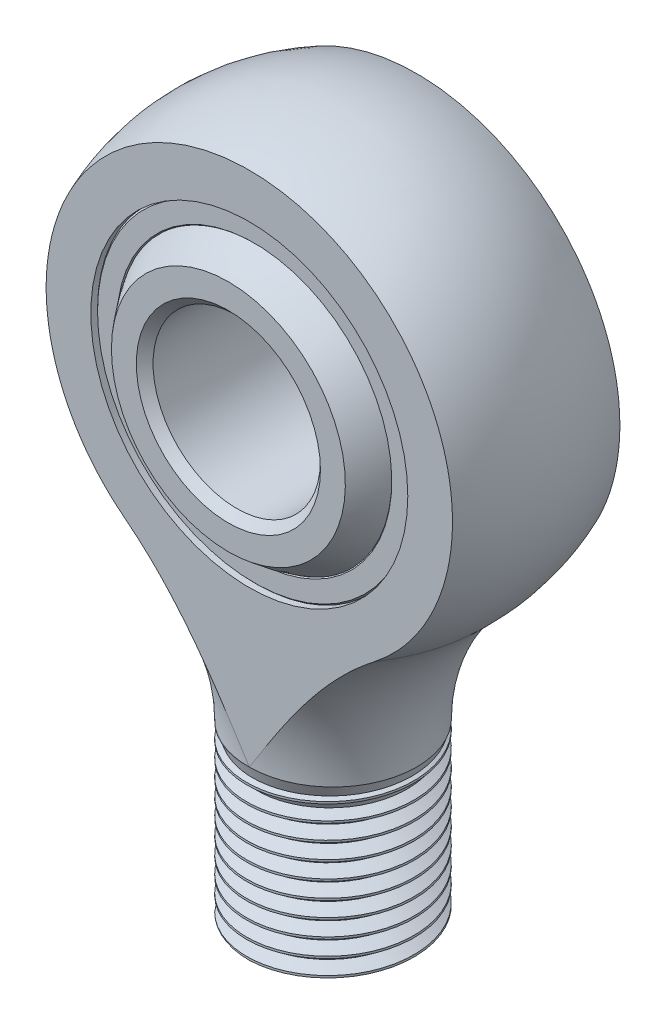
SolidWorks part; units mm, degrees
other "Chamfer3"
other "Chamfer1"
other "Chamfer4"
other "Boss-Extrude1"
ref_plane "Front" through (0, 0, 0) normal (0, 0, 1) x (1, 0, 0)
ref_plane "Top" through (0, 0, 0) normal (0, 1, 0) x (1, 0, 0)
ref_plane "Right" through (0, 0, 0) normal (1, 0, 0) x (0, 0, -1)
imported_body "Imported1"
imported_body "Imported2"
imported_body "Imported3"
imported_body "Imported4"
sketch "Sketch1" plane through (0, -38.1, 0) normal (0, -1, 0) x (1, 0, 0)
  circle A0 centre (0, 0) radius 7.6117
extrude "Cut-Extrude1" cut sketch "Sketch1" against normal blind 25.4
